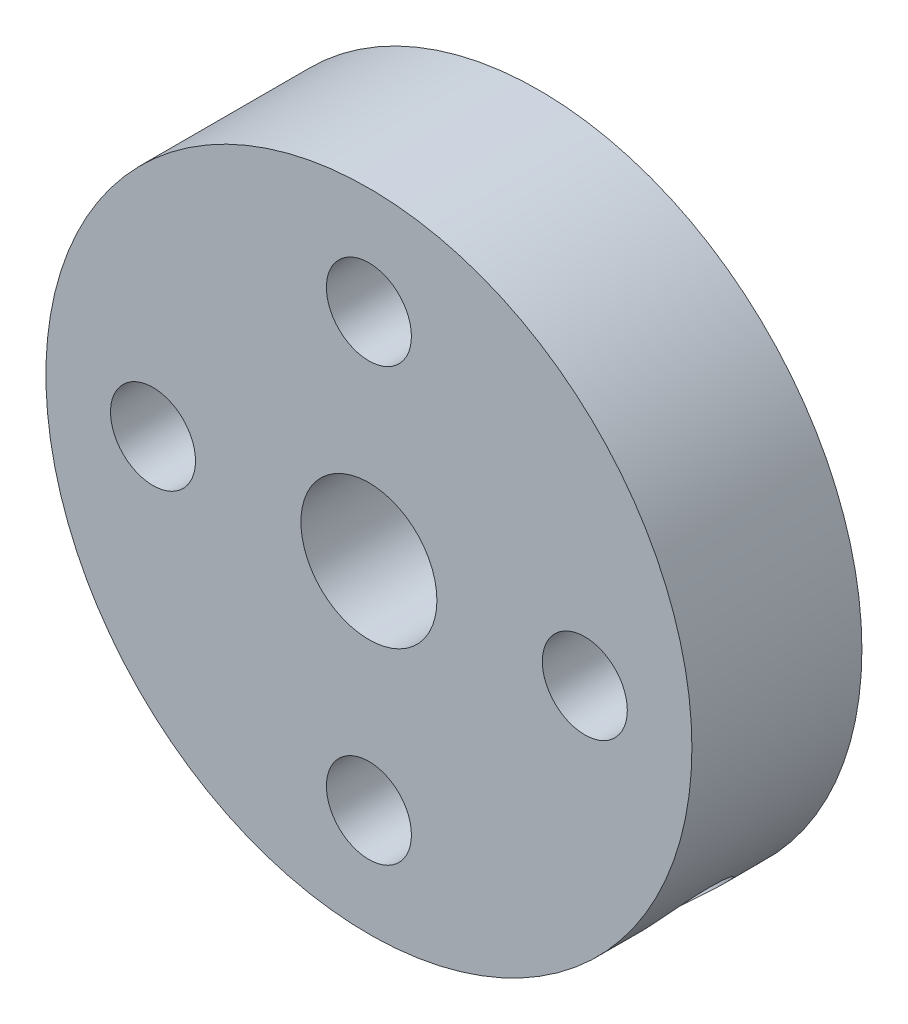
SolidWorks part; units mm, degrees
ref_plane "Front" through (0, 0, 0) normal (0, 0, 1) x (1, 0, 0)
ref_plane "Top" through (0, 0, 0) normal (0, 1, 0) x (1, 0, 0)
ref_plane "Right" through (0, 0, 0) normal (1, 0, 0) x (0, 0, -1)
sketch "Sketch1" plane through (0, 0, 0) normal (0, 0, 1) x (1, 0, 0)
  circle A0 centre (0, 0) radius 9.5
  dimension "D1" = 19
extrude "Boss-Extrude1" add sketch "Sketch1" along normal blind 5
hole_wizard "Ø4.0 (4) Diameter Hole1" positions "Sketch2" profile "Sketch3" hole size "Ø4.0" standard "ANSI Metric"
sketch "Sketch2" plane through (0, 0, 5) normal (0, 0, 1) x (1, 0, 0)
  point P0 (0, 0)
sketch "Sketch3" plane through (0, 0, 5) normal (1, 0, 0) x (0, -1, 0)
  line L0 (0, 0) -> (0, 5)
  line L1 (0, 5) -> (2, 5)
  line L2 (2, 5) -> (2, 0)
  line L5 (2, 0) -> (0, 0)
  line L11 (0, -6.35) -> (0, 107.95) construction
  dimension "Thru Hole Dia." = 4
  dimension "Thru Hole Depth" = 5
hole_wizard "M3x0.5 Tapped Hole1" positions "Sketch4" profile "Sketch5" tap size "M3x0.5" standard "ANSI Metric"
sketch "Sketch4" plane through (0, 0, 5) normal (0, 0, 1) x (1, 0, 0)
  line L0 (0, 0) -> (6.35, 0) construction
  line L2 (0, 0) -> (0, 6.35) construction
  point P0 (6.35, 0)
  point P11 (0, -6.35)
  point P12 (-6.35, 0)
  point P13 (0, 6.35)
  point P14 (0, 0)
  dimension "D1" = 6.35
  dimension "D2" = 4
sketch "Sketch5" plane through (6.35, 0, 5) normal (1, 0, 0) x (0, -1, 0)
  line L0 (0, 0) -> (0, 5)
  line L1 (0, 5) -> (1.25, 5)
  line L2 (1.25, 5) -> (1.25, 0)
  line L5 (1.25, 0) -> (0, 0)
  line L11 (0, -6.35) -> (0, 107.95) construction
  dimension "Thru Tap Drill Dia." = 2.5
  dimension "Thru Tap Drill Depth" = 5
ref_plane "Plane1" through (0, 0, 0) normal (0.7071, 0.7071, 0) x (0, 0, -1)
ref_plane "Plane2" through (6.7175, -6.7175, 0) normal (0.7071, -0.7071, 0) x (-0.7071, -0.7071, 0)
hole_wizard "M3x0.5 Tapped Hole4" positions "Sketch8" profile "Sketch9" tap size "M3x0.5" standard "ANSI Metric"
sketch "Sketch8" plane through (6.7175, -6.7175, 0) normal (0.7071, -0.7071, 0) x (-0.7071, -0.7071, 0)
  line L0 (0, -5) -> (0, 0) construction
  point P0 (0, -2.5)
sketch "Sketch9" plane through (6.7175, -6.7175, 2.5) normal (0, 0, 1) x (0.7071, 0.7071, 0)
  line L0 (0, 0) -> (0, 7.5)
  line L1 (0, 7.5) -> (1.25, 7.5)
  line L2 (1.25, 7.5) -> (1.25, 0)
  line L5 (1.25, 0) -> (0, 0)
  line L11 (0, -6.35) -> (0, 107.95) construction
  dimension "Thru Tap Drill Dia." = 2.5
  dimension "Thru Tap Drill Depth" = 7.5
